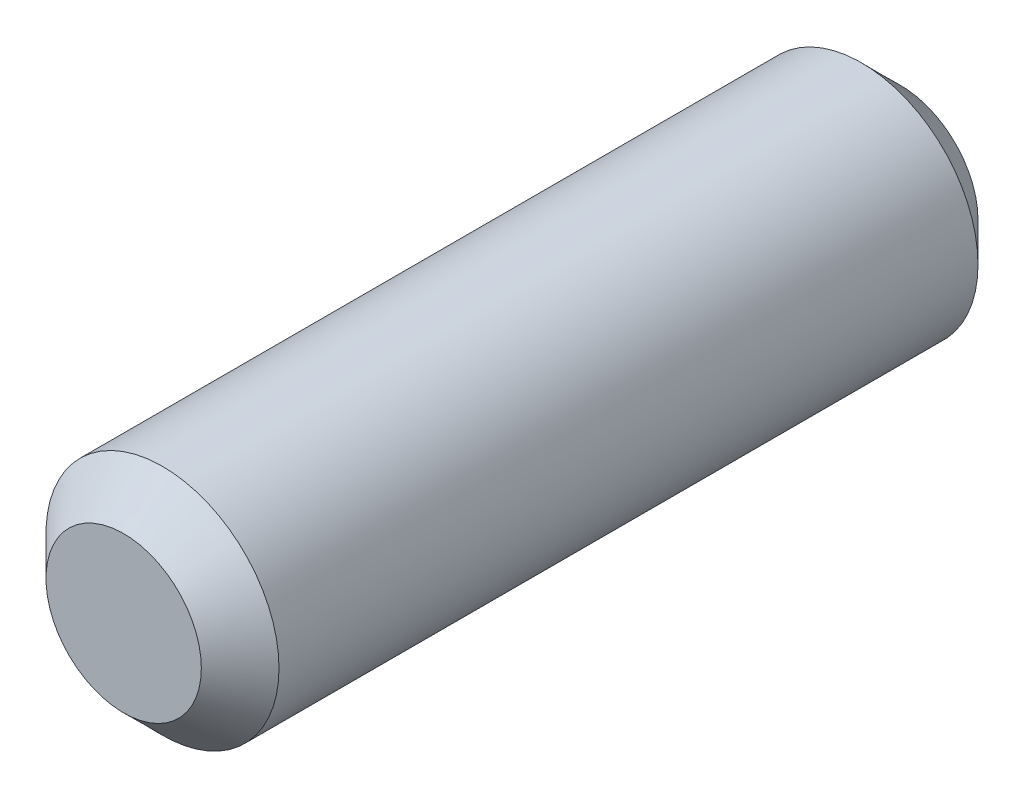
SolidWorks part; units mm, degrees
ref_plane "Plan de face" through (0, 0, 0) normal (0, 0, 1) x (1, 0, 0)
ref_plane "Plan de dessus" through (0, 0, 0) normal (0, 1, 0) x (1, 0, 0)
ref_plane "Plan de droite" through (0, 0, 0) normal (1, 0, 0) x (0, 0, -1)
sketch "Esquisse1" plane through (0, 0, 0) normal (0, 0, 1) x (1, 0, 0)
  circle A0 centre (0, 0) radius 3
  dimension "D1" = 6
extrude "Extrusion1" add sketch "Esquisse1" along normal blind 20
chamfer "Chanfrein1" distance 1 angle 45 2 edges at (3, 0, 0) (3, 0, 20)
